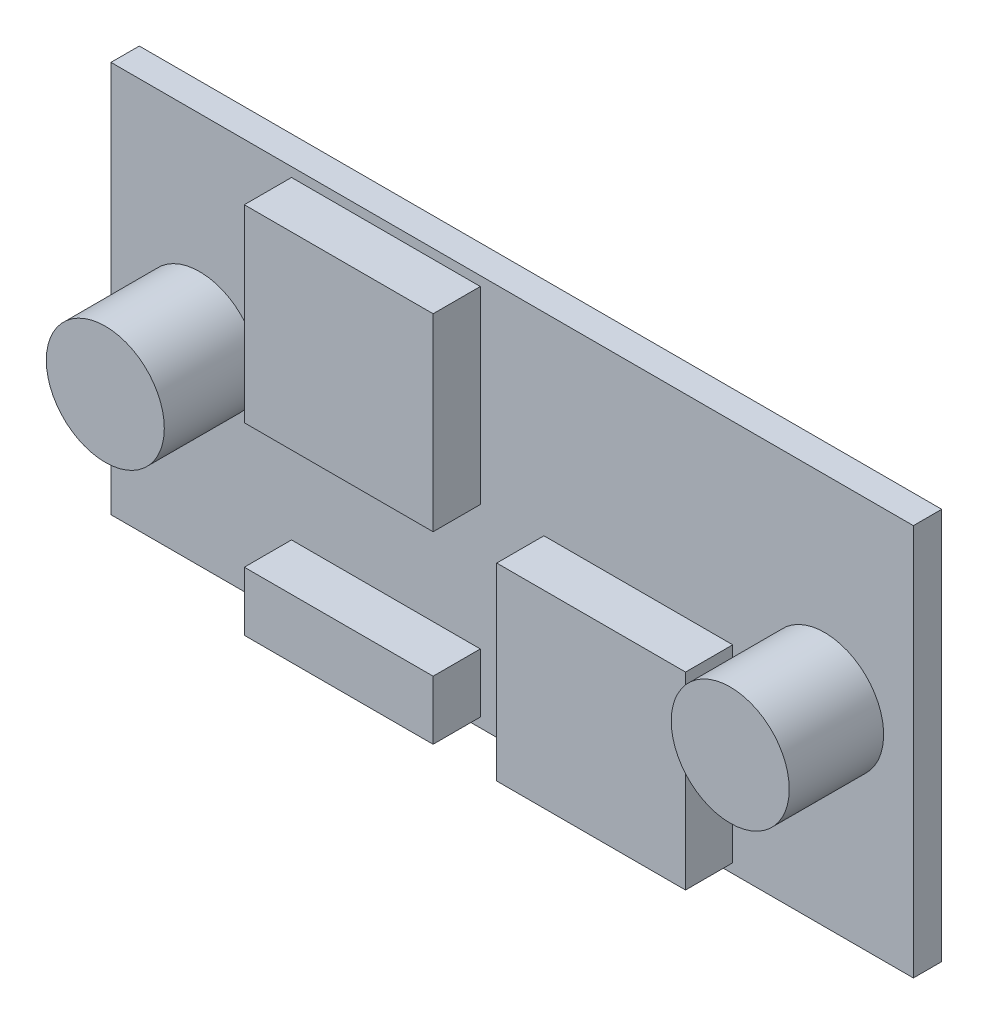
SolidWorks part; units mm, degrees
ref_plane "Front Plane" through (0, 0, 0) normal (0, 0, 1) x (1, 0, 0)
ref_plane "Top Plane" through (0, 0, 0) normal (0, 1, 0) x (1, 0, 0)
ref_plane "Right Plane" through (0, 0, 0) normal (1, 0, 0) x (0, 0, -1)
sketch "Sketch1" plane through (0, 0, 0) normal (0, 0, 1) x (1, 0, 0)
  line L1 (0, 0) -> (43.18, 0)
  line L2 (0, 0) -> (0, 21.082)
  line L3 (0, 21.082) -> (43.18, 21.082)
  line L4 (43.18, 0) -> (43.18, 21.082)
  dimension "D1" = 43.18
  dimension "D2" = 21.082
extrude "Boss-Extrude1" add sketch "Sketch1" along normal blind 1.524
sketch "Sketch2" plane through (0, 0, 1.524) normal (0, 0, 1) x (1, 0, 0)
  line L0 (43.18, 0) -> (43.18, 21.082) construction
  line L1 (0, 21.082) -> (0, 0) construction
  line L2 (43.18, 21.082) -> (0, 21.082) construction
  line L3 (9.7154, 3.683) -> (19.8754, 3.683)
  line L4 (9.7154, 3.683) -> (9.7154, 0.508)
  line L5 (9.7154, 0.508) -> (19.8754, 0.508)
  line L6 (19.8754, 3.683) -> (19.8754, 0.508)
  line L7 (23.2989, 0.508) -> (33.4589, 0.508)
  line L8 (23.2989, 0.508) -> (23.2989, 10.668)
  line L9 (23.2989, 10.668) -> (33.4589, 10.668)
  line L10 (33.4589, 0.508) -> (33.4589, 10.668)
  line L11 (9.7154, 20.574) -> (19.8754, 20.574)
  line L12 (9.7154, 20.574) -> (9.7154, 10.414)
  line L13 (9.7154, 10.414) -> (19.8754, 10.414)
  line L14 (19.8754, 20.574) -> (19.8754, 10.414)
  line L15 (0, 0) -> (43.18, 0) construction
  circle A0 centre (4.7752, 10.541) radius 3.175
  circle A1 centre (38.4048, 10.541) radius 3.175
  dimension "D1" = 6.35
  dimension "D2" = 6.35
  dimension "D3" = 4.7752
  dimension "D4" = 4.7752
  dimension "D5" = 10.16
  dimension "D6" = 10.16
  dimension "D7" = 0.508
  dimension "D8" = 10.16
  dimension "D9" = 3.175
  dimension "D10" = 0.508
  dimension "D11" = 10.16
  dimension "D12" = 10.16
  dimension "D13" = 0.508
extrude "Boss-Extrude2" add sketch "Sketch2" along normal blind 2.54
sketch "Sketch3" plane through (0, 0, 4.064) normal (0, 0, 1) x (1, 0, 0)
  circle A0 centre (4.7752, 10.541) radius 3.175
  circle A1 centre (38.4048, 10.541) radius 3.175
extrude "Boss-Extrude3" add sketch "Sketch3" along normal blind 2.54
